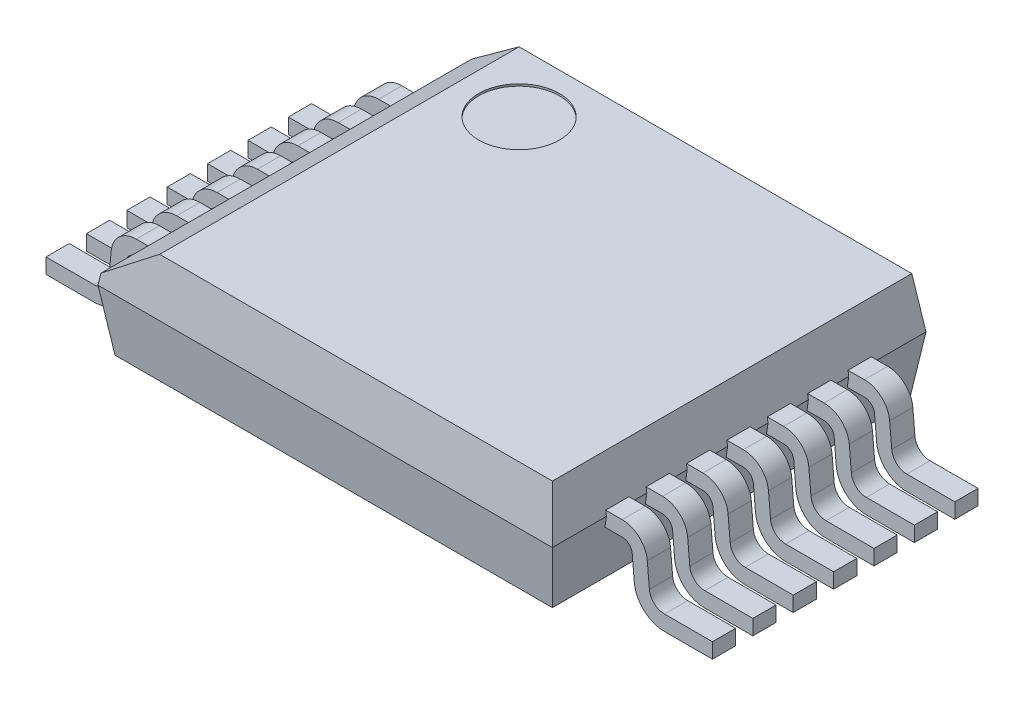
SolidWorks part; units mm, degrees
ref_plane "Front" through (0, 0, 0) normal (0, 0, 1) x (1, 0, 0)
ref_plane "Top" through (0, 0, 0) normal (0, 1, 0) x (1, 0, 0)
ref_plane "Right" through (0, 0, 0) normal (1, 0, 0) x (0, 0, -1)
ref_plane "ПлоскостьВывод1" through (0, 0, -1.2) normal (0, 0, 1) x (1, 0, 0)
sketch "ЭскизВывод1" plane through (0, 0, -1.2) normal (0, 0, 1) x (1, 0, 0)
  line L0 (-3.3, 0) -> (-2.8249, 0)
  line L1 (-2.526, 0.2739) -> (-2.5055, 0.5087)
  line L2 (-2.4059, 0.6) -> (2.4059, 0.6)
  line L3 (0, 0.6) -> (0, 0) construction
  line L4 (2.526, 0.2739) -> (2.5055, 0.5087)
  line L5 (3.3, 0) -> (2.8249, 0)
  arc A0 (-2.5055, 0.5087) -> (-2.4059, 0.6) centre (-2.4059, 0.5) cw
  arc A1 (-2.8249, 0) -> (-2.526, 0.2739) centre (-2.8249, 0.3) ccw
  arc A2 (2.8249, 0) -> (2.526, 0.2739) centre (2.8249, 0.3) cw
  arc A3 (2.5055, 0.5087) -> (2.4059, 0.6) centre (2.4059, 0.5) ccw
  point P8 (-2.4975, 0.6)
  point P11 (-2.55, 0)
  dimension "D6" = 0.1
  dimension "D7" = 0.3
  dimension "E" = 6.6
  dimension "A_mid_lead" = 0.6
  dimension "L" = 0.75
  dimension "D4" = 85
  dimension "D5" = 4.995
extrude "Вывод1" add sketch "ЭскизВывод1" along normal mid plane 0.23 thin
ref_plane "ПлоскостьКорпус" through (0, 0.7, 0) normal (0, 1, 0) x (-1, 0, 0)
sketch "ЭскизКорпус" plane through (0, 0.7, 0) normal (0, 1, 0) x (1, 0, 0)
  line L1 (2.25, -1.85) -> (-2.25, -1.85)
  line L2 (2.25, -1.85) -> (2.25, 1.85)
  line L3 (2.25, 1.85) -> (-2.25, 1.85)
  line L4 (-2.25, -1.85) -> (-2.25, 1.85)
  line L5 (2.25, -1.85) -> (-2.25, 1.85) construction
  line L6 (2.25, 1.85) -> (-2.25, -1.85) construction
  point P0 (0, 0)
  dimension "D" = 3.7
  dimension "E" = 4.5
extrude "Корпус" add sketch "ЭскизКорпус" along normal offset from surface 1.2 draft 8 and the other way offset from surface (0.6 mm away) 0.1 draft 8
pattern_linear "Выводы" count 7 spacing 0.4 along (0, 0, 1) of "Вывод1"
chamfer "Фаска1" distance 0.4 angle 45 1 edges at (-2.1797, 1.2, 0)
sketch "Эскиз3" plane through (0, 1.2, 0) normal (0, 1, 0) x (1, 0, 0)
  line L0 (-1.7097, 1.1797) -> (-1.1097, 1.1797) construction
  line L1 (-1.7097, 1.7797) -> (-1.7097, -1.7797) construction
  line L2 (-1.1097, 1.1797) -> (-1.1097, 1.7797) construction
  line L3 (2.1797, 1.7797) -> (-1.7097, 1.7797) construction
  circle A0 centre (-1.1097, 1.1797) radius 0.4
  dimension "D2" = 0.8
  dimension "D1" = 0.6
extrude "Вытянуть3" cut sketch "Эскиз3" against normal blind 0.02
sketch "SkThermalPad" plane through (0, 0.7, 0) normal (0, 1, 0) x (-1, 0, 0)
  line L1 (1.25, 1.25) -> (-1.25, 1.25)
  line L2 (1.25, 1.25) -> (1.25, -1.25)
  line L3 (1.25, -1.25) -> (-1.25, -1.25)
  line L4 (-1.25, 1.25) -> (-1.25, -1.25)
  line L5 (1.25, 1.25) -> (-1.25, -1.25) construction
  line L6 (1.25, -1.25) -> (-1.25, 1.25) construction
  point P0 (0, 0)
  dimension "D1" = 2.5
  dimension "E2" = 2.5
extrude "ThermalPad" [suppressed] add sketch "SkThermalPad" against normal up to surface (0.95 mm away)
